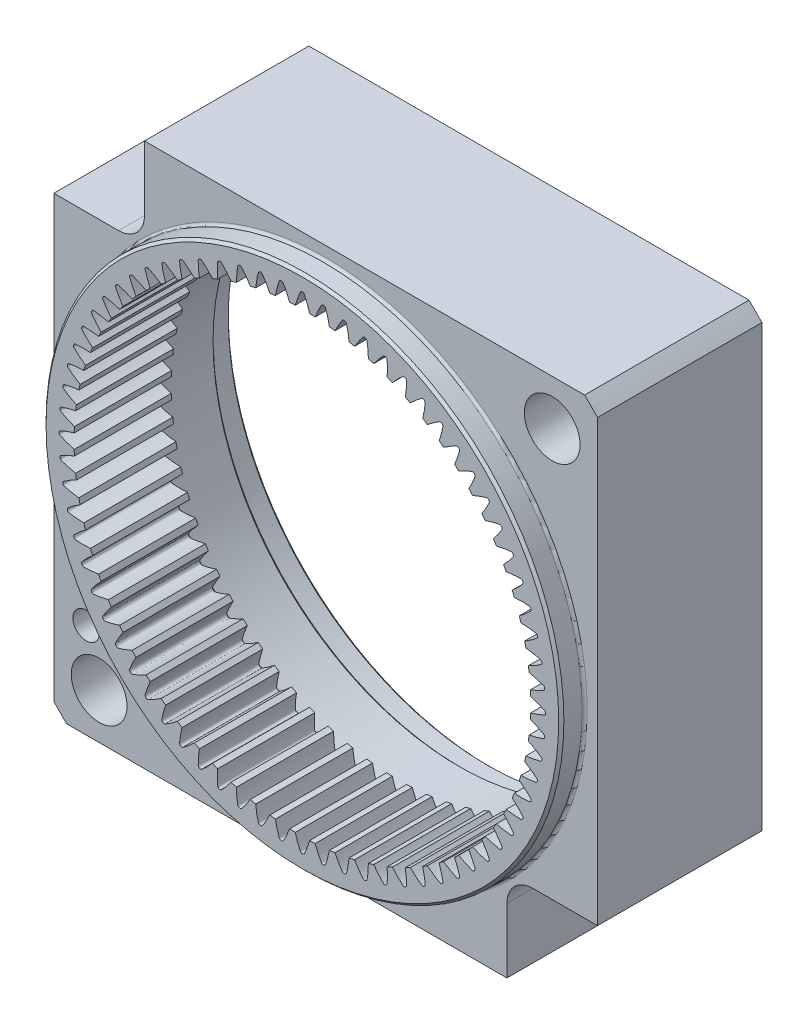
SolidWorks part; units mm, degrees
other "<217-2816-001 Rev1>-<Imported1>"
ref_plane "Front Plane" through (0, 0, 0) normal (0, 0, 1) x (1, 0, 0)
ref_plane "Top Plane" through (0, 0, 0) normal (0, 1, 0) x (1, 0, 0)
ref_plane "Right Plane" through (0, 0, 0) normal (1, 0, 0) x (0, 0, -1)
mirrored part "217-2816-001 Rev1_Mirrored"
